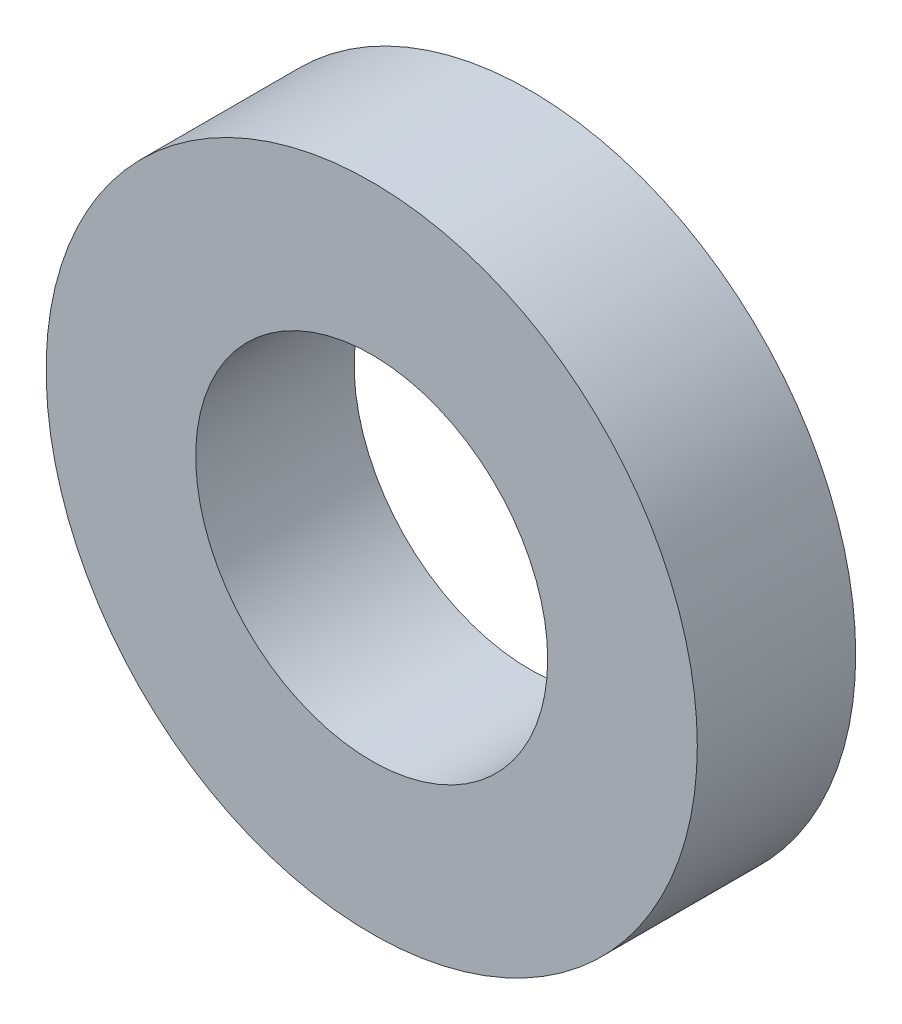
SolidWorks part; units mm, degrees
ref_plane "Front Plane" through (0, 0, 0) normal (0, 0, 1) x (1, 0, 0)
ref_plane "Top Plane" through (0, 0, 0) normal (0, 1, 0) x (1, 0, 0)
ref_plane "Right Plane" through (0, 0, 0) normal (1, 0, 0) x (0, 0, -1)
sketch "Sketch1" plane through (0, 0, 0) normal (0, 0, 1) x (1, 0, 0)
  circle A0 centre (0, 0) radius 10
  circle A1 centre (0, 0) radius 18.5
  dimension "D1" = 20
  dimension "D2" = 37
extrude "Boss-Extrude1" add sketch "Sketch1" along normal blind 9
